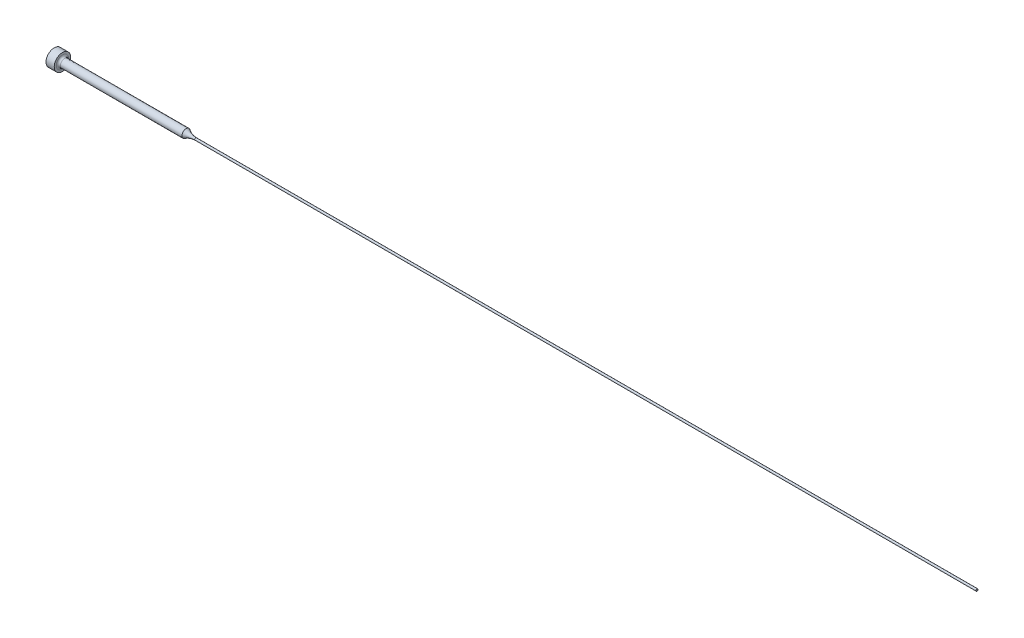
SolidWorks part; units mm, degrees
ref_plane "Front Plane" through (0, 0, 0) normal (0, 0, 1) x (1, 0, 0)
ref_plane "Top Plane" through (0, 0, 0) normal (0, 1, 0) x (1, 0, 0)
ref_plane "Right Plane" through (0, 0, 0) normal (1, 0, 0) x (0, 0, -1)
sketch "Sketch1" plane through (0, 0, 0) normal (0, 0, 1) x (1, 0, 0)
  line L0 (355.6, 0) -> (0, 0) construction
  line L1 (0, 0) -> (0, 3.175)
  line L2 (0, 3.175) -> (3.175, 3.175)
  line L3 (3.175, 3.175) -> (3.175, 2.3812)
  line L4 (3.9688, 1.5875) -> (50.8, 1.5875)
  line L5 (54.5115, 0.3899) -> (355.6, 0.3899)
  line L6 (355.6, 0.3899) -> (355.6, 0)
  line L7 (355.6, 0) -> (0, 0)
  line L8 (0, 0) -> (-6.0795, 0) construction
  line L9 (109.1867, 0) -> (355.6, 0) construction
  arc A0 (3.175, 2.3812) -> (3.9688, 1.5875) centre (3.9688, 2.3813) ccw
  arc A1 (50.8, 1.5875) -> (54.5115, 0.3899) centre (54.5115, 6.7399) ccw
  dimension "D1" = 3.175
  dimension "D2" = 6.35
  dimension "PinDia" = 0.7798
  dimension "HeadDia" = 6.35
  dimension "HeadThickness" = 3.175
  dimension "Shoulder" = 50.8
  dimension "OverallLength" = 355.6
revolve "Revolve1" add sketch "Sketch1" angle 360 about L0
